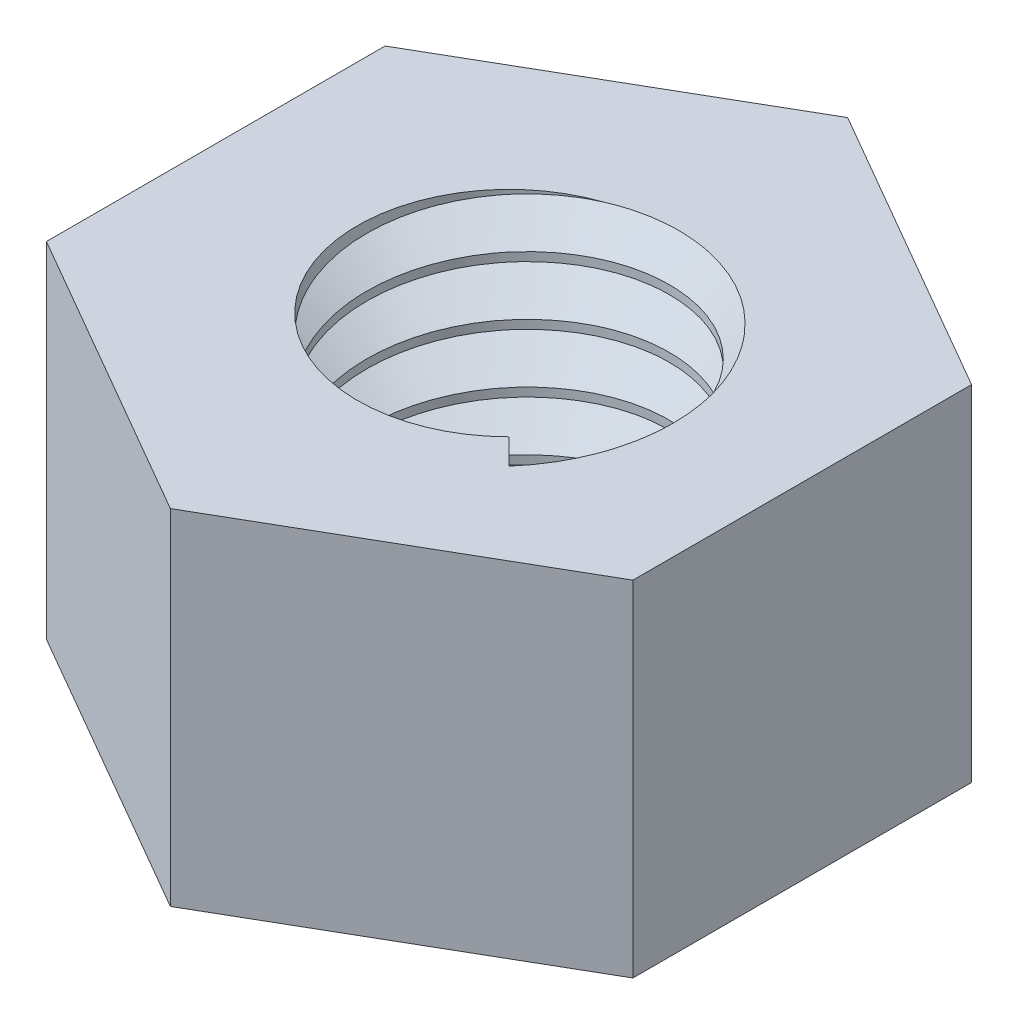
SolidWorks part; units mm, degrees
ref_plane "Alzado" through (0, 0, 0) normal (0, 0, 1) x (1, 0, 0)
ref_plane "Planta" through (0, 0, 0) normal (0, 1, 0) x (1, 0, 0)
ref_plane "Vista lateral" through (0, 0, 0) normal (1, 0, 0) x (0, 0, -1)
sketch "Sk_Hexagono" plane through (0, 0, 0) normal (0, 1, 0) x (1, 0, 0)
  line L0 (4, -2.3094) -> (0, -4.6188)
  line L1 (0, -4.6188) -> (-4, -2.3094)
  line L2 (-4, -2.3094) -> (-4, 2.3094)
  line L3 (-4, 2.3094) -> (0, 4.6188)
  line L4 (0, 4.6188) -> (4, 2.3094)
  line L5 (4, 2.3094) -> (4, -2.3094)
extrude "Hexagono" add sketch "Sk_Hexagono" along normal blind 4.7 from offset 0
sketch3d "Sk_Taladro"
  line L0 (0, -1, 0) -> (0, 5.7, 0)
  dimension "D1" = 6.7
sweep "Taladro" cut path "Sk_Taladro" parameters "D3"=4.134
sketch "Sk_Helice" plane through (0, 0, 0) normal (0, 1, 0) x (1, 0, 0)
  circle A0 centre (0, 0) radius 2.067
curve "Helice_rosca"
sketch "Sk_Perfil_rosca" plane through (0, 0, 0) normal (1, 0, 0) x (0, 0, -1)
  line L0 (-1.867, -0.48) -> (-2.5577, 0)
  line L1 (-2.5577, 0) -> (-1.867, 0.48)
  line L2 (-1.867, 0.48) -> (-1.867, -0.48)
sweep "Rosca_M5x0,8" cut profiles "Sk_Perfil_rosca" path "Helice_rosca"
